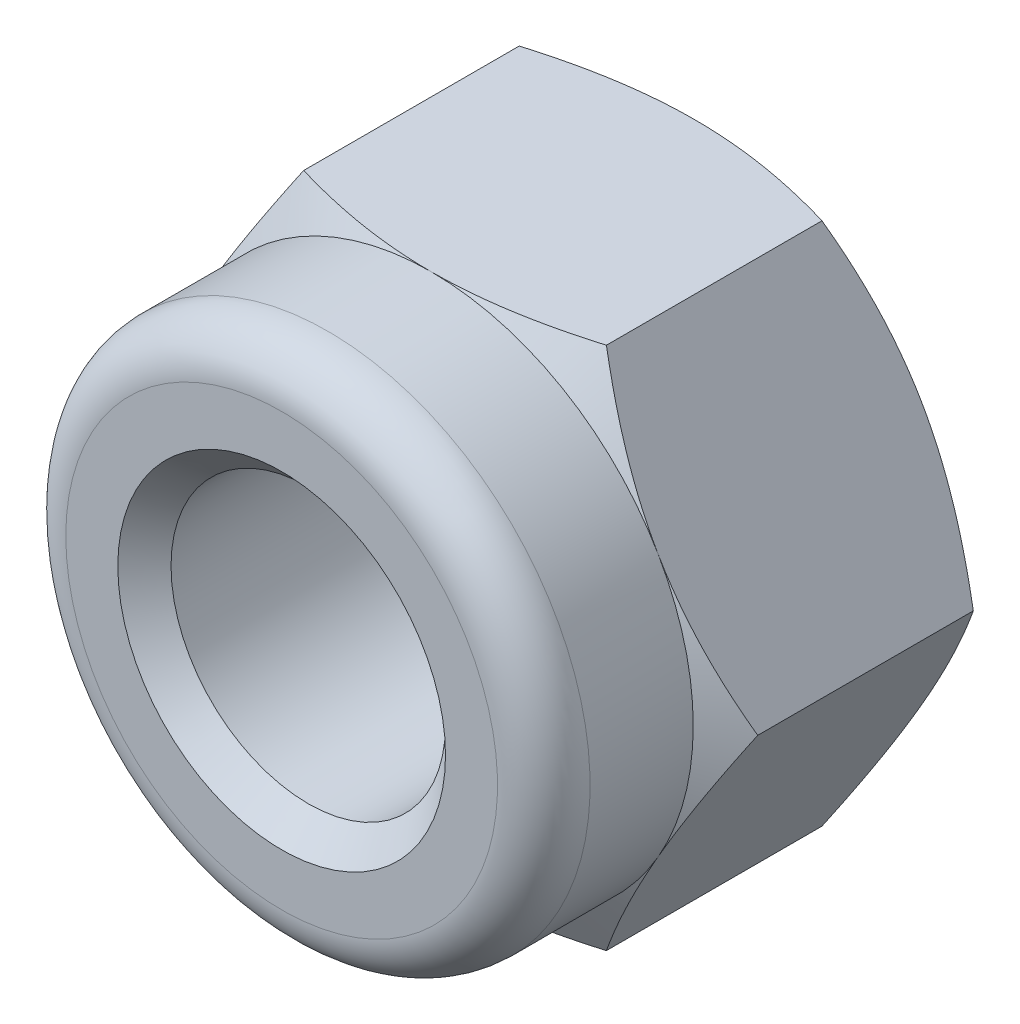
SolidWorks part; units mm, degrees
ref_plane "Plan1" through (0, 0, 0) normal (0, 0, 1) x (1, 0, 0)
ref_plane "Plan2" through (0, 0, 0) normal (0, 1, 0) x (1, 0, 0)
ref_plane "Plan3" through (0, 0, 0) normal (1, 0, 0) x (0, 0, -1)
sketch "Sketch1" plane through (0, 0, 0) normal (0, 0, 1) x (1, 0, 0)
  line L0 (-9.2376, 0) -> (9.2376, 0) construction
  line L1 (0, 8) -> (0, -8) construction
  line L2 (-4.6188, 8) -> (4.6188, 8)
  line L3 (4.6188, 8) -> (9.2376, 0)
  line L4 (9.2376, 0) -> (4.6188, -8)
  line L5 (4.6188, -8) -> (-4.6188, -8)
  line L6 (-4.6188, -8) -> (-9.2376, 0)
  line L7 (-9.2376, 0) -> (-4.6188, 8)
  dimension "D1" = 120
  dimension "S" = 16
extrude "Base-Extrude" add sketch "Sketch1" along normal blind 8.04
sketch "Sketch2" plane through (0, 0, 0) normal (0, 1, 0) x (1, 0, 0)
  line L0 (-9.2376, 0) -> (-9.2376, -0.7309)
  line L1 (-9.2376, -8.04) -> (-9.2376, 0) construction
  line L2 (-9.2376, -0.7309) -> (-8, 0)
  line L4 (-4.6188, 0) -> (-9.2376, 0) construction
  line L5 (0, 0) -> (0, -8.04) construction
  line L6 (4.6188, -8.04) -> (-4.6188, -8.04) construction
  line L7 (4.6188, 0) -> (-4.6188, 0) construction
  line L8 (-8, 0) -> (-9.2376, 0)
  line L9 (-9.2376, -8.04) -> (-9.2376, -7.3091)
  line L10 (-9.2376, -7.3091) -> (-8, -8.04)
  line L11 (-4.6188, -8.04) -> (-9.2376, -8.04) construction
  line L12 (-8, -8.04) -> (-9.2376, -8.04)
  line L13 (0, 0) -> (0, -1.5) construction
  dimension "D1" = 0.7309
  dimension "P" = 1.5
revolve "Cut-Revolve1" cut sketch "Sketch2" angle 360 about L5
sketch "Sketch3" plane through (0, 0, 0) normal (0, 0, -1) x (-1, 0, 0)
  circle A0 centre (0, 0) radius 8
  arc A1 (-6.9282, 4) -> (-6.9282, -4) centre (0, 0) ccw construction
extrude "Boss-Extrude1" add sketch "Sketch3" against normal blind 12.6
fillet "Fillet1" radius 1.4125 1 edges at (-8, 0, 12.6)
other "Hole1"
sketch "Sketch4" plane through (0, 0, 0) normal (0, 0, -1) x (-1, 0, 0)
  circle A0 centre (0, 0) radius 4.1881
  arc A1 (-6.9282, 4) -> (-6.9282, -4) centre (0, 0) ccw construction
  dimension "D1" = 8.3763
chamfer "Chamfer1" distance 0.8119 angle 45 2 edges at (-4.1881, 0, 12.6) (-4.1881, 0, 0)
equation "\"D1@Sketch2\" = \"M@Base-Extrude\" / 11"
equation "\"D1@Fillet1\" = ((\"S@Sketch1\"*1.1547)-\"D@Cosmetic_Thread1\")/6"
equation "\"D1@Sketch4\" = \"D@Cosmetic_Thread1\"-(1.0825*\"P@Sketch2\")"
equation "\"D1@Chamfer1\" = (\"D@Cosmetic_Thread1\"-\"D1@Sketch4\")/2"
equation "\"S@Sketch2\" = \"S@Sketch1\""
